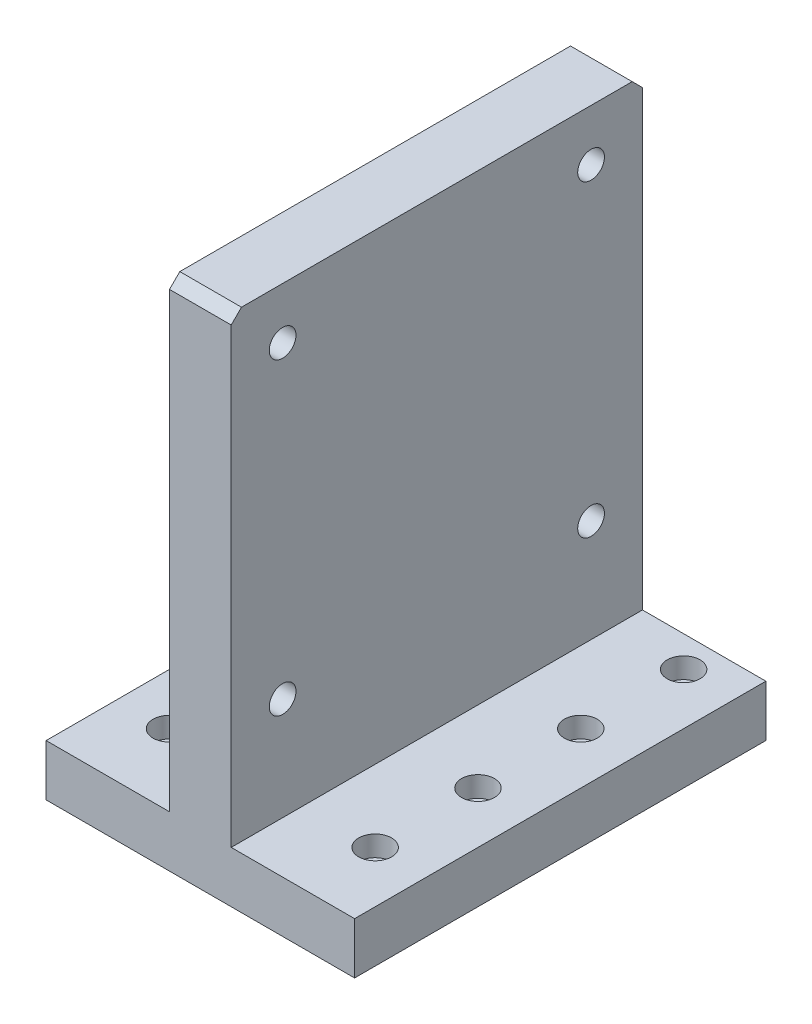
SolidWorks part; units mm, degrees
ref_plane "Plan1" through (0, 0, 0) normal (0, 0, 1) x (1, 0, 0)
ref_plane "Plan2" through (0, 0, 0) normal (0, 1, 0) x (1, 0, 0)
ref_plane "Plan3" through (0, 0, 0) normal (1, 0, 0) x (0, 0, -1)
sketch "Esquisse1" plane through (0, 0, 0) normal (0, 0, 1) x (1, 0, 0)
  line L0 (-15, 250) -> (15, 250)
  line L1 (15, 250) -> (15, 25)
  line L2 (15, 25) -> (75, 25)
  line L3 (75, 25) -> (75, 0)
  line L4 (75, 0) -> (-75, 0)
  line L5 (-75, 0) -> (-75, 25)
  line L6 (-75, 25) -> (-15, 25)
  line L7 (-15, 25) -> (-15, 250)
  dimension "D1" = 30
  dimension "D2" = 25
  dimension "D3" = 25
  dimension "D4" = 75
  dimension "D5" = 75
  dimension "D6" = 15
  dimension "D7" = 250
extrude "Base-Extrusion" add sketch "Esquisse1" along normal blind 200
sketch "Esquisse2" plane through (0, 0, 0) normal (1, 0, 0) x (0, 0, -1)
  line L0 (30, 225) -> (-210, 225) construction
  line L1 (50, 75) -> (-230, 75) construction
  line L2 (-25, 260) -> (-25, 10) construction
  line L3 (-175, 260) -> (-175, -10) construction
  circle A0 centre (-25, 225) radius 6.5
  circle A1 centre (-175, 225) radius 6.5
  circle A2 centre (-25, 75) radius 6.5
  circle A3 centre (-175, 75) radius 6.5
  dimension "D1" = 13
  dimension "D2" = 13
  dimension "D3" = 13
  dimension "D4" = 13
  dimension "D5" = 75
  dimension "D6" = 150
  dimension "D7" = 25
  dimension "D8" = 150
extrude "Enlèv. mat.-Extru.1" cut sketch "Esquisse2" against normal mid plane 200
chamfer "Chanfrein1" distance 5 angle 45
sketch "Esquisse4" plane through (0, 0, 0) normal (0, 1, 0) x (1, 0, 0)
  line L0 (0, 0) -> (0, -210) construction
  line L1 (-50, 0) -> (-50, -200) construction
  line L2 (-15, 0) -> (-75, 0) construction
  line L3 (50, 10) -> (50, -210) construction
  line L4 (-90, -15) -> (80, -15) construction
  line L5 (-90, -65) -> (120, -65) construction
  line L6 (-90, -115) -> (130, -115) construction
  line L7 (-110, -165) -> (130, -165) construction
  circle A0 centre (-50, -15) radius 5
  circle A1 centre (-50, -65) radius 5
  circle A2 centre (-50, -115) radius 5
  circle A3 centre (-50, -165) radius 5
  circle A4 centre (50, -165) radius 5
  circle A5 centre (50, -115) radius 5
  circle A6 centre (50, -65) radius 5
  circle A7 centre (50, -15) radius 5
  dimension "D7" = 10
  dimension "D8" = 10
  dimension "D9" = 10
  dimension "D10" = 10
  dimension "D11" = 10
  dimension "D12" = 10
  dimension "D13" = 10
  dimension "D14" = 10
  dimension "D1" = 50
  dimension "D2" = 50
  dimension "D3" = 50
  dimension "D4" = 50
  dimension "D5" = 50
  dimension "D6" = 15
extrude "Enlèv. mat.-Extru.3" cut sketch "Esquisse4" along normal blind 30
ref_plane "Plan4" through (0, 25, 0) normal (0, 1, 0) x (-1, 0, 0)
sketch "Esquisse6" plane through (0, 25, 0) normal (0, 1, 0) x (-1, 0, 0)
  circle A0 centre (-50, 165) radius 8
  circle A1 centre (50, 165) radius 8
  circle A2 centre (-50, 115) radius 8
  circle A3 centre (50, 115) radius 8
  circle A4 centre (-50, 65) radius 8
  circle A5 centre (50, 65) radius 8
  circle A6 centre (-50, 15) radius 8
  circle A7 centre (50, 15) radius 8
  dimension "D1" = 16
  dimension "D2" = 16
  dimension "D3" = 16
  dimension "D4" = 16
  dimension "D5" = 16
  dimension "D6" = 16
  dimension "D7" = 16
  dimension "D8" = 16
extrude "Enlèv. mat.-Extru.4" cut sketch "Esquisse6" against normal blind 10
sketch "Esquisse7" plane through (0, 0, 0) normal (0, 1, 0) x (1, 0, 0)
  line L0 (0, 0) -> (0, -190) construction
  line L1 (-100, -90) -> (110, -90) construction
  line L2 (75, 0) -> (15, 0) construction
  circle A0 centre (0, -90) radius 10
  dimension "D2" = 20
  dimension "D1" = 90
extrude "Enlèv. mat.-Extru.5" cut sketch "Esquisse7" along normal blind 20
sketch "Esquisse8" plane through (0, 0, 0) normal (0, 1, 0) x (1, 0, 0)
  line L0 (-10, 0) -> (-10, -30)
  line L1 (-15, 0) -> (-75, 0) construction
  line L2 (10, 0) -> (10, -30)
  line L3 (75, 0) -> (15, 0) construction
  line L4 (0, 0) -> (0, -190) construction
  line L5 (-10, 0) -> (10, 0)
  arc A0 (-10, -30) -> (10, -30) centre (0, -30) ccw
  dimension "D1" = 10
  dimension "D2" = 20
  dimension "D3" = 30
extrude "Enlèv. mat.-Extru.6" cut sketch "Esquisse8" along normal blind 5
